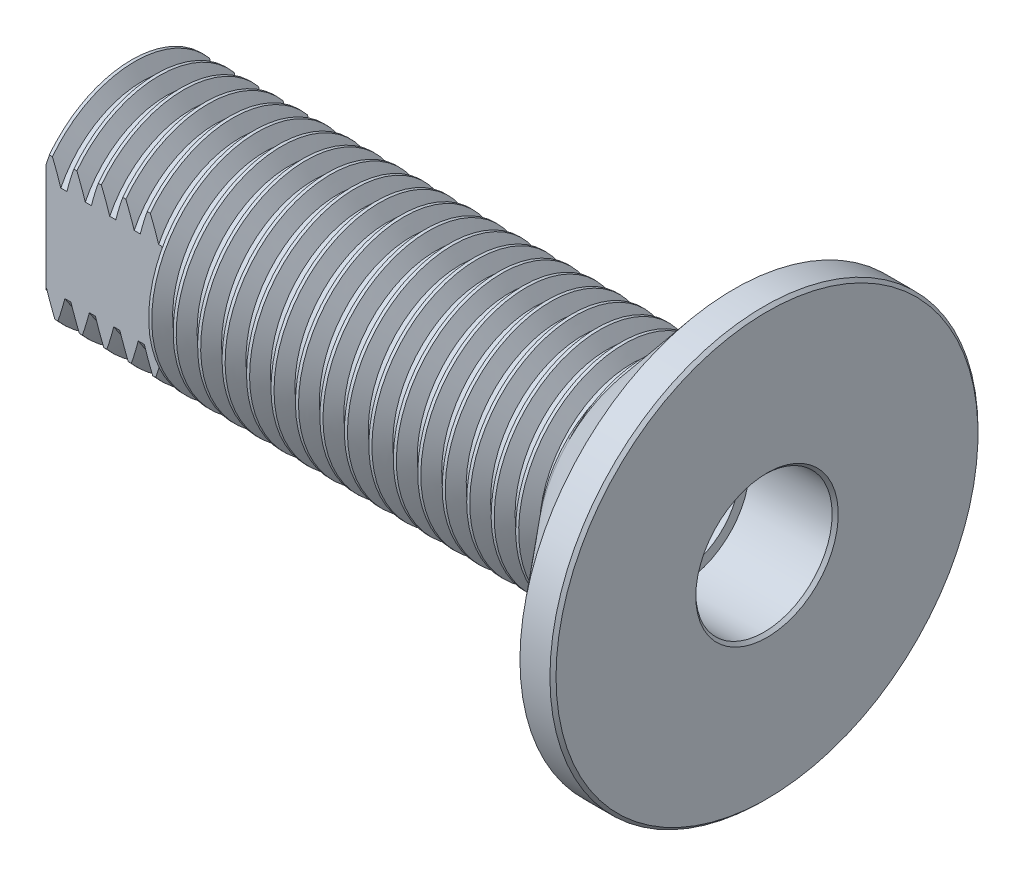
SolidWorks part; units mm, degrees
ref_plane "Płaszczyzna przednia" through (0, 0, 0) normal (0, 0, 1) x (1, 0, 0)
ref_plane "Płaszczyzna górna" through (0, 0, 0) normal (0, 1, 0) x (1, 0, 0)
ref_plane "Płaszczyzna prawa" through (0, 0, 0) normal (1, 0, 0) x (0, 0, -1)
sketch "Szkic1" plane through (0, 0, 0) normal (0, 0, 1) x (1, 0, 0)
  line L0 (0, 0) -> (18463.2908, 0) construction
  line L1 (0, 3.25) -> (0, 17.6)
  line L2 (0, 17.6) -> (14.6003, 35)
  line L3 (14.6003, 35) -> (20, 35)
  line L4 (20, 35) -> (20, 3.25)
  line L5 (20, 3.25) -> (0, 3.25)
  dimension "D1" = 6.5
  dimension "D2" = 70
  dimension "D3" = 35.2
  dimension "D4" = 140
  dimension "D5" = 20
revolve "Obrót1" add sketch "Szkic1" angle 360 about L0
sketch "Szkic2" plane through (20, 0, 0) normal (1, 0, 0) x (0, 0, -1)
  circle A0 centre (0, 0) radius 11.15
  dimension "D1" = 22.3
extrude "Wytnij-wyciągnięcie1" cut sketch "Szkic2" against normal blind 14
sketch "Szkic3" plane through (6, 0, 0) normal (1, 0, 0) x (0, 0, -1)
  circle A0 centre (0, 0) radius 9.5
  dimension "D1" = 19
extrude "Wytnij-wyciągnięcie2" cut sketch "Szkic3" against normal through all
sketch "Szkic4" plane through (0, 0, 0) normal (-1, 0, 0) x (0, 0, 1)
  circle A0 centre (0, 0) radius 9.5 construction
  circle A1 centre (0, 0) radius 17.6 construction
  circle A2 centre (0, 0) radius 9.5
  circle A3 centre (0, 0) radius 17.6
extrude "Dodanie-wyciągnięcie1" add sketch "Szkic4" along normal blind 85
sketch "Szkic5" plane through (-85, 0, 0) normal (-1, 0, 0) x (0, 0, 1)
  circle A0 centre (0, 0) radius 11.15
  dimension "D1" = 22.3
extrude "Wytnij-wyciągnięcie3" cut sketch "Szkic5" against normal blind 45
thread "Gwint1" pitch 4 start angle 0, offset 4, length 0, pitch 4, diameter 35.2
ref_plane "Płaszczyzna1" through (-89, 0, -17.6) normal (0, -1, 0) x (0, 0, -1)
sketch "Profil gwintu1" plane through (-89, 0, -17.6) normal (0, -1, 0) x (0, 0, -1)
  line L0 (0, 0) -> (0, 4) construction
  line L11 (0, 0) -> (0, 3.5)
  line L12 (0, 3.5) -> (-2.1651, 2.25)
  line L13 (-2.1651, 2.25) -> (-2.1651, 1.25)
  line L15 (-2.1651, 1.25) -> (0, 0)
  line L17 (-2.1651, 1.75) -> (0, 1.75) construction
  point P2 (0, 0)
  dimension "Pitch" = 4
  dimension "Profile_Angle" = 60
  dimension "Profile_Land" = 1
  dimension "Profile_Height" = 2.1651
sketch "Szkic10" plane through (-85, 0, 0) normal (-1, 0, 0) x (0, 0, 1)
  line L1 (-13.4, -24.4365) -> (13.4, -24.4365)
  line L2 (-13.4, -24.4365) -> (-13.4, 24.4365)
  line L3 (-13.4, 24.4365) -> (13.4, 24.4365)
  line L4 (13.4, -24.4365) -> (13.4, 24.4365)
  line L5 (0, 24.4365) -> (0, -24.4365) construction
  line L6 (-13.4, 0) -> (13.4, 0) construction
  point P0 (0, 0)
  dimension "D1" = 26.8
extrude "Wytnij-wyciągnięcie4" cut sketch "Szkic10" against normal blind 20 flip side to cut
chamfer "Sfazowanie1" distance 0.5 angle 45 7 edges at (20, 0, 35) (20, 0, -11.15) (-85, 0.1574, 13.4) (-85, 0.5723, -13.4) (-65, 0.5723, -13.4) (-65, 0.1574, 13.4) (-85, 0, 11.15)
